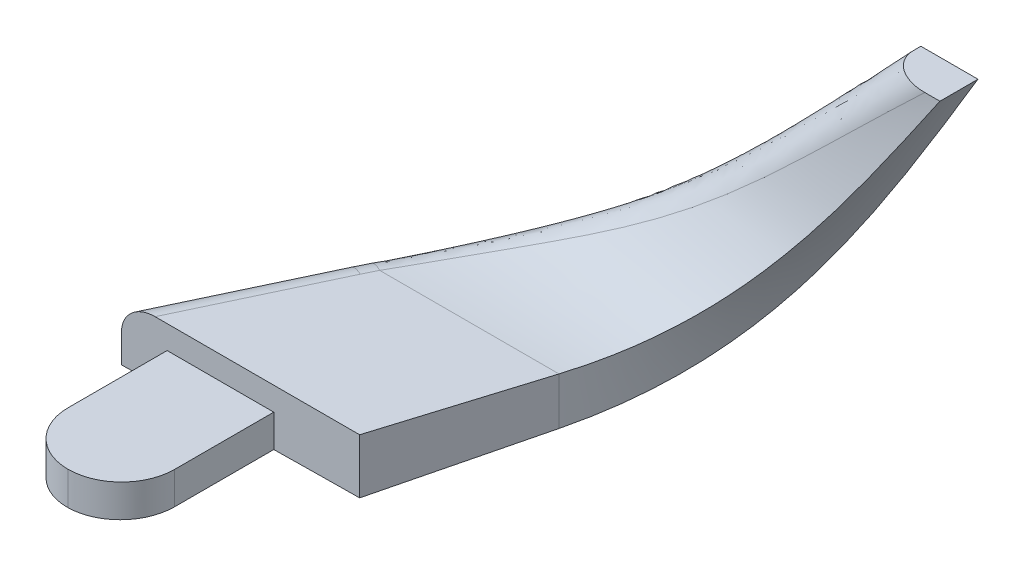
SolidWorks part; units mm, degrees
ref_plane "Plan de face" through (0, 0, 0) normal (0, 0, 1) x (1, 0, 0)
ref_plane "Plan de dessus" through (0, 0, 0) normal (0, 1, 0) x (1, 0, 0)
ref_plane "Plan de droite" through (0, 0, 0) normal (1, 0, 0) x (0, 0, -1)
imported_body "Importée3"
sketch "Esquisse1" plane through (0, 5.0584, 0) normal (0, 1, 0) x (-1, 0, 0)
  line L0 (-70.5168, -107) -> (-70.5168, -97)
  line L1 (-70.5168, -97) -> (-54.8814, -97)
  line L2 (-54.8814, -97) -> (-54.8814, -107)
  line L3 (-54.8814, -107) -> (-70.5168, -107)
  line L4 (-70.5168, -97) -> (-70.5168, -107) construction
  line L5 (-70.5168, -107) -> (-54.8814, -107) construction
  dimension "D1" = 15.6354
  dimension "D2" = 10
extrude "Boss.-Extru.1" add sketch "Esquisse1" along normal blind 3.1416
draft "Dépouille1" type of draft neutral plane draft angle 17.136 faces to draft 1 parameters "D1"=17.136
draft "Dépouille2" type of draft neutral plane draft angle 25.261 faces to draft 1 parameters "D1"=25.261
sketch "Esquisse2" plane through (0, 0, -107) normal (0, 0, -1) x (-1, 0, 0)
  line L3 (-59.6, 4.8649) -> (-59.6, 8.2)
  line L4 (-59.6, 8.2) -> (-73.6, 8.2)
  line L5 (-73.6, 8.2) -> (-73.6, 5.0957)
  line L6 (-59.6, 4.8649) -> (-59.6, 8.2)
  line L7 (-59.6, 8.2) -> (-73.6, 8.2)
  line L8 (-73.6, 8.2) -> (-73.6, 5.0957)
  arc A0 (-59.6, 4.8649) -> (-73.6, 5.0957) centre (-87.0026, -1232.7717) ccw
  arc A1 (-59.6, 4.8649) -> (-73.6, 5.0957) centre (-87.0026, -1232.7717) ccw
  dimension "D1" = 0
ref_plane "Plan1" through (0, 26.2, 0) normal (0, 1, 0) x (1, 0, 0)
sketch "Esquisse3" plane through (0, 26.2, 0) normal (0, 1, 0) x (1, 0, 0)
  line L1 (84.85, 119.5) -> (88.6, 119.5)
  line L2 (84.85, 119.5) -> (84.85, 117)
  line L3 (84.85, 117) -> (88.6, 117)
  line L4 (88.6, 119.5) -> (88.6, 117)
  line L5 (73.6, 107) -> (59.6, 107) construction
  dimension "D1" = 2.5
  dimension "D2" = 3.75
  dimension "D3" = 15
  dimension "D4" = 12.5
loft "Lissage1" add profiles "Esquisse2", "Esquisse3"
fillet "Congé1" radius 2 2 edges at (57.2407, 8.2, -102)
sketch "Esquisse4" plane through (0, 0, -97) normal (0, 0, 1) x (1, 0, 0)
  line L0 (64.8814, 4.5408) -> (64.8814, 6.6677)
  line L1 (64.8814, 6.6677) -> (57.8814, 6.6677)
  line L2 (57.8814, 6.6677) -> (57.8814, 4.4177)
  line L3 (54.8814, 6.2) -> (54.8814, 4.3527) construction
  spline S0 degree 3 poles (-1547.2372, -1109.0344) (-482.4658, 371.9771) (607.0344, 357.1812) (1719.4171, -1041.754) knots -103.616335 -103.616335 -103.616335 -103.616335 105.324578 105.324578 105.324578 105.324578 only from (54.8814, 4.3527) to (70.5168, 4.6112) construction
  spline S1 degree 3 poles (57.8814, 4.4177) (60.2146, 4.4653) (62.5479, 4.5064) (64.8814, 4.5408) knots 0.191889 0.191889 0.191889 0.191889 0.639599 0.639599 0.639599 0.639599
  dimension "D1" = 3
  dimension "D2" = 7
  dimension "D3" = 2.25
extrude "Boss.-Extru.2" add sketch "Esquisse4" along normal blind 10
fillet "Congé2" radius 3.5 2 edges
